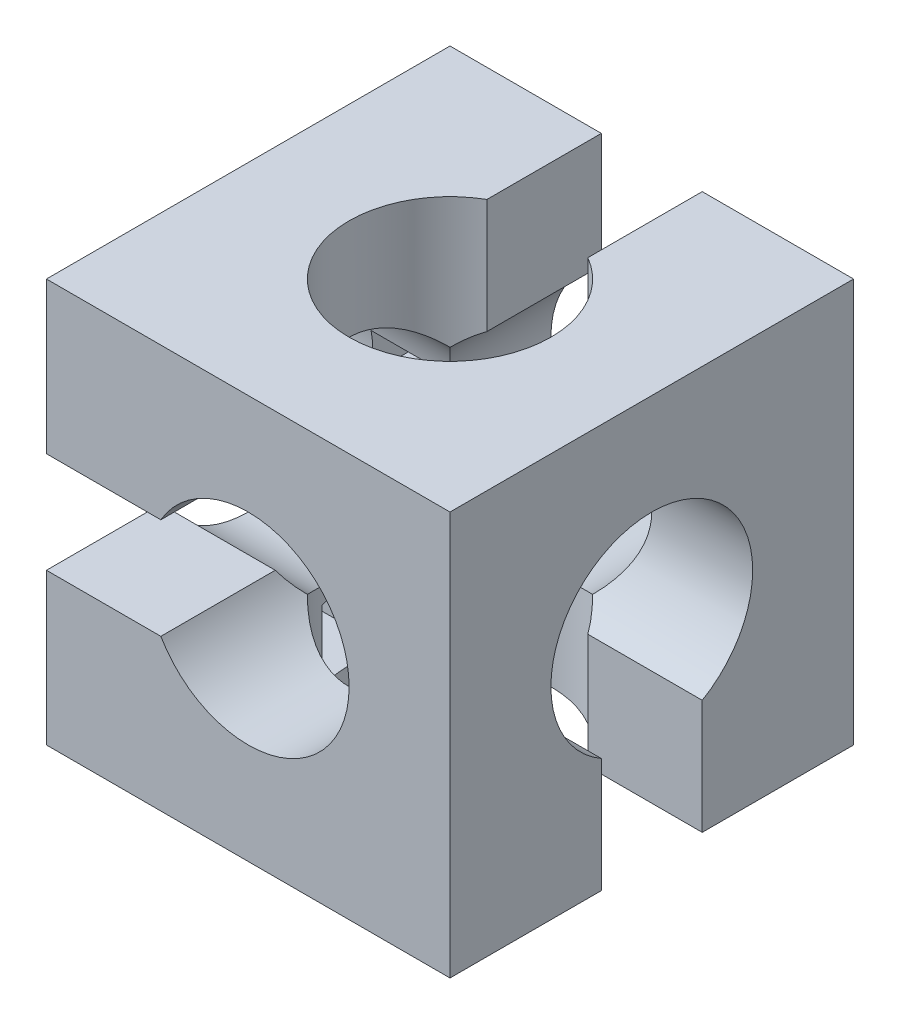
SolidWorks part; units mm, degrees
ref_plane "Plan de face" through (0, 0, 0) normal (0, 0, 1) x (1, 0, 0)
ref_plane "Plan de dessus" through (0, 0, 0) normal (0, 1, 0) x (1, 0, 0)
ref_plane "Plan de droite" through (0, 0, 0) normal (1, 0, 0) x (0, 0, -1)
sketch "Esquisse1" plane through (0, 0, 0) normal (0, 0, 1) x (1, 0, 0)
  line L1 (-20, -20) -> (20, -20)
  line L2 (-20, -20) -> (-20, 20)
  line L3 (-20, 20) -> (20, 20)
  line L4 (20, -20) -> (20, 20)
  line L5 (-20, -20) -> (20, 20) construction
  line L6 (-20, 20) -> (20, -20) construction
  point P0 (0, 0)
  dimension "D1" = 40
extrude "Boss.-Extru.1" add sketch "Esquisse1" along normal blind 40
sketch "Esquisse2" plane through (0, 0, 40) normal (0, 0, 1) x (1, 0, 0)
  circle A0 centre (0, 0) radius 10
  dimension "D1" = 20
extrude "Enlèv. mat.-Extru.1" cut sketch "Esquisse2" against normal up to next
sketch "Esquisse3" plane through (-20, 0, 0) normal (-1, 0, 0) x (0, 0, 1)
  circle A0 centre (20, 0) radius 10
  dimension "D1" = 20
extrude "Enlèv. mat.-Extru.2" cut sketch "Esquisse3" against normal through all
sketch "Esquisse5" plane through (0, 20, 0) normal (0, 1, 0) x (1, 0, 0)
  circle A0 centre (0, -20) radius 10
  dimension "D1" = 20
extrude "Enlèv. mat.-Extru.3" cut sketch "Esquisse5" against normal through all
sketch "Esquisse6" plane through (0, 20, 0) normal (0, 1, 0) x (1, 0, 0)
  line L1 (-5, 13.9181) -> (5, 13.9181)
  line L2 (-5, 13.9181) -> (-5, -13.9181)
  line L3 (-5, -13.9181) -> (5, -13.9181)
  line L4 (5, 13.9181) -> (5, -13.9181)
  line L5 (-5, 13.9181) -> (5, -13.9181) construction
  line L6 (-5, -13.9181) -> (5, 13.9181) construction
  point P0 (0, 0)
  dimension "D1" = 10
extrude "Enlèv. mat.-Extru.4" cut sketch "Esquisse6" against normal blind 20
sketch "Esquisse7" plane through (20, 0, 0) normal (1, 0, 0) x (0, 0, -1)
  line L0 (-40, -20) -> (0, -20) construction
  line L1 (-25, -34.8357) -> (-15, -34.8357)
  line L2 (-25, -34.8357) -> (-25, -5.1643)
  line L3 (-25, -5.1643) -> (-15, -5.1643)
  line L4 (-15, -34.8357) -> (-15, -5.1643)
  line L5 (-25, -34.8357) -> (-15, -5.1643) construction
  line L6 (-25, -5.1643) -> (-15, -34.8357) construction
  point P0 (-20, -20)
  dimension "D1" = 10
extrude "Enlèv. mat.-Extru.5" cut sketch "Esquisse7" against normal blind 20
sketch "Esquisse8" plane through (0, 0, 40) normal (0, 0, 1) x (1, 0, 0)
  line L0 (-20, 20) -> (-20, -20) construction
  line L1 (-35.8559, -5) -> (-4.1441, -5)
  line L2 (-35.8559, -5) -> (-35.8559, 5)
  line L3 (-35.8559, 5) -> (-4.1441, 5)
  line L4 (-4.1441, -5) -> (-4.1441, 5)
  line L5 (-35.8559, -5) -> (-4.1441, 5) construction
  line L6 (-35.8559, 5) -> (-4.1441, -5) construction
  point P0 (-20, 0)
  dimension "D1" = 10
extrude "Enlèv. mat.-Extru.6" cut sketch "Esquisse8" against normal blind 20
sketch "Esquisse9" plane through (-20, 0, 0) normal (-1, 0, 0) x (0, 0, 1)
  line L1 (32.2283, 2.0697) -> (37.3911, 2.0697)
  line L2 (32.2283, 2.0697) -> (32.2283, -2.0697)
  line L3 (32.2283, -2.0697) -> (37.3911, -2.0697)
  line L4 (37.3911, 2.0697) -> (37.3911, -2.0697)
  line L5 (32.2283, 2.0697) -> (37.3911, -2.0697) construction
  line L6 (32.2283, -2.0697) -> (37.3911, 2.0697) construction
  point P0 (34.8097, 0)
extrude "Enlèv. mat.-Extru.7" cut sketch "Esquisse9" against normal blind 37
sketch "Esquisse10" plane through (0, 0, 40) normal (0, 0, 1) x (1, 0, 0)
  line L1 (-17.652, -1.8454) -> (-12.5299, -1.8454)
  line L2 (-17.652, -1.8454) -> (-17.652, 1.8454)
  line L3 (-17.652, 1.8454) -> (-12.5299, 1.8454)
  line L4 (-12.5299, -1.8454) -> (-12.5299, 1.8454)
  line L5 (-17.652, -1.8454) -> (-12.5299, 1.8454) construction
  line L6 (-17.652, 1.8454) -> (-12.5299, -1.8454) construction
  point P0 (-15.0909, 0)
extrude "Enlèv. mat.-Extru.8" cut sketch "Esquisse10" against normal blind 37
sketch "Esquisse11" plane through (0, 0, 0) normal (0, 0, -1) x (-1, 0, 0)
  line L1 (-1.4554, 17.5145) -> (1.4554, 17.5145)
  line L2 (-1.4554, 17.5145) -> (-1.4554, 12.7514)
  line L3 (-1.4554, 12.7514) -> (1.4554, 12.7514)
  line L4 (1.4554, 17.5145) -> (1.4554, 12.7514)
  line L5 (-1.4554, 17.5145) -> (1.4554, 12.7514) construction
  line L6 (-1.4554, 12.7514) -> (1.4554, 17.5145) construction
  point P0 (0, 15.133)
extrude "Enlèv. mat.-Extru.9" cut sketch "Esquisse11" against normal blind 37
sketch "Esquisse12" plane through (20, 0, 0) normal (1, 0, 0) x (0, 0, -1)
  line L1 (-16.6862, -18.1697) -> (-23.2153, -18.1697)
  line L2 (-16.6862, -18.1697) -> (-16.6862, -11.1252)
  line L3 (-16.6862, -11.1252) -> (-23.2153, -11.1252)
  line L4 (-23.2153, -18.1697) -> (-23.2153, -11.1252)
  line L5 (-16.6862, -18.1697) -> (-23.2153, -11.1252) construction
  line L6 (-16.6862, -11.1252) -> (-23.2153, -18.1697) construction
  point P0 (-19.9507, -14.6474)
extrude "Enlèv. mat.-Extru.10" cut sketch "Esquisse12" against normal blind 37
